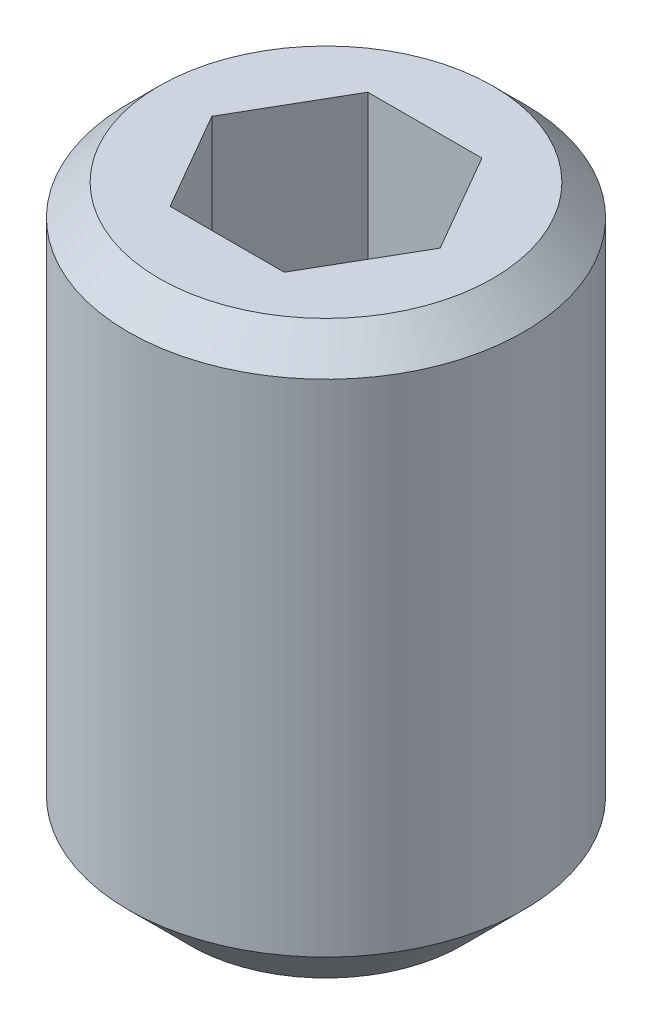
SolidWorks part; units mm, degrees
ref_plane "Plane1" through (0, 0, 0) normal (0, 0, 1) x (1, 0, 0)
ref_plane "Plane2" through (0, 0, 0) normal (0, 1, 0) x (1, 0, 0)
ref_plane "Plane3" through (0, 0, 0) normal (1, 0, 0) x (0, 0, -1)
sketch "Esquisse1" plane through (0, 0, 0) normal (0, 1, 0) x (1, 0, 0)
  circle A0 centre (0, 0) radius 4
  dimension "D1" = 8
extrude "Longueur filté" add sketch "Esquisse1" along normal blind 12
chamfer "Chanfrein1" distance 0.625 angle 45 1 edges at (0, 12, 4)
sketch "Esquisse6" plane through (0, 12, 0) normal (0, -1, 0) x (-1, 0, 0)
  line L1 (2.3094, 0) -> (1.1547, 2)
  line L2 (1.1547, 2) -> (-1.1547, 2)
  line L3 (-1.1547, 2) -> (-2.3094, 0)
  line L4 (-2.3094, 0) -> (-1.1547, -2)
  line L5 (-1.1547, -2) -> (1.1547, -2)
  line L6 (1.1547, -2) -> (2.3094, 0)
  circle A0 centre (0, 0) radius 2 construction
  dimension "S" = 4
extrude "Enlèv. mat.-Extru.4" cut sketch "Esquisse6" along normal blind 5
sketch "Esquisse7" plane through (0, 0, 0) normal (0, -1, 0) x (1, 0, 0)
  circle A0 centre (0, 0) radius 2.75
  dimension "Dz" = 5.5
extrude "Enlèv. mat.-Extru.6" cut sketch "Esquisse7" against normal through all draft 45 flip side to cut
equation "\"Ch@Chanfrein1\" = (\"D1@Esquisse1\"-\"D2@Représentation de filetage1\")/2"
